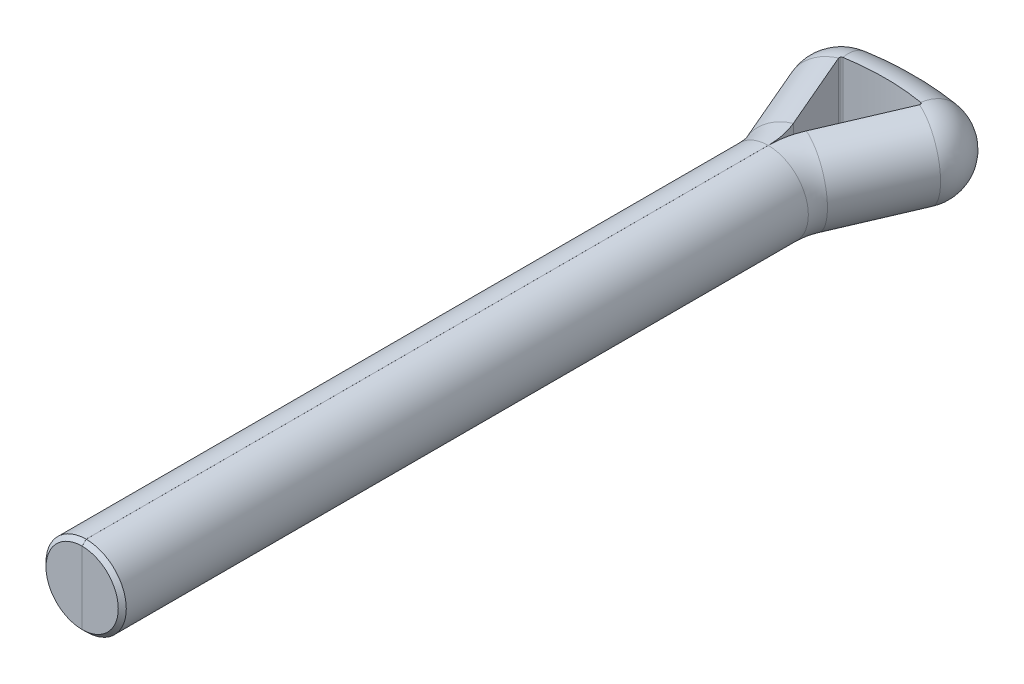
SolidWorks part; units mm, degrees
ref_plane "Front Plane" through (0, 0, 0) normal (0, 0, 1) x (1, 0, 0)
ref_plane "Top Plane" through (0, 0, 0) normal (0, 1, 0) x (1, 0, 0)
ref_plane "Right Plane" through (0, 0, 0) normal (1, 0, 0) x (0, 0, -1)
sketch "Sketch1" plane through (0, 0, 0) normal (0, 0, 1) x (1, 0, 0)
  line L0 (0, 1) -> (0, -1)
  arc A0 (0, -1) -> (0, 1) centre (0, 0) ccw
  dimension "D1" = 2
sketch "Sketch2" plane through (0, 0, 0) normal (0, 1, 0) x (1, 0, 0)
  line L1 (0.1619, 17.8775) -> (1.0077, 19.8502)
  line L4 (1.0327, 19.9083) -> (1.0327, 17.5) construction
  line L5 (-1.0327, 17.5) -> (1.0327, 17.5) construction
  line L6 (0, 17.5) -> (0, 20) construction
  line L7 (0, 17.0893) -> (0, 0)
  arc A0 (0.9701, 19.9192) -> (0, 20) centre (0, 14.1366) ccw
  arc A3 (1.0077, 19.8502) -> (0.9701, 19.9192) centre (0.9618, 19.8699) ccw
  arc A4 (0, 17.0893) -> (0.1619, 17.8775) centre (2, 17.0893) cw
  dimension "D7" = 0.05
  dimension "D8" = 2
  dimension "D2" = 5.8634
  dimension "D1" = 17.5
  dimension "D3" = 20
  dimension "D4" = 0.1619
sweep "Sweep3" add profiles "Sketch1" path "Sketch2"
mirror "Mirror1" about plane through (0, 0, 0) normal (1, 0, 0) of "Sweep3"
sketch "Sketch3" plane through (0, 0, 0) normal (0, 0, 1) x (1, 0, 0)
  line L0 (0, 1) -> (0, -1) construction
  line L1 (-0.0005, 1) -> (-0.0005, -1)
  line L2 (0.0005, 1) -> (0.0005, -1)
  line L3 (-0.0005, 1) -> (0.0005, 1)
  line L5 (0.0005, -1) -> (-0.0005, -1)
  circle A0 centre (0, 0) radius 1 construction
  dimension "D1" = 0.001
extrude "Cut-Extrude1" cut sketch "Sketch3" against normal up to next
chamfer "Chamfer1" distance 0.1 angle 45 2 edges at (-1, 0, 0) (1, 0, 0)
